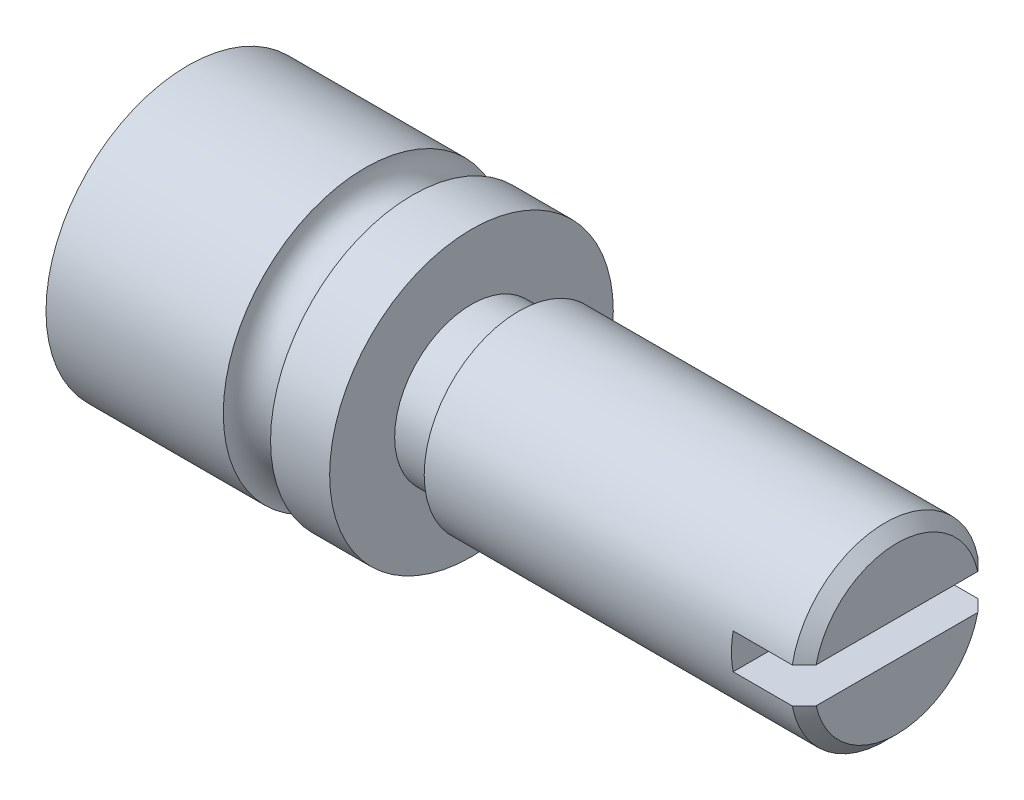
SolidWorks part; units mm, degrees
ref_plane "Face" through (0, 0, 0) normal (0, 0, 1) x (1, 0, 0)
ref_plane "Dessus" through (0, 0, 0) normal (0, 1, 0) x (1, 0, 0)
ref_plane "Droite" through (0, 0, 0) normal (1, 0, 0) x (0, 0, -1)
sketch "Esquisse1" plane through (0, 0, 0) normal (0, 0, 1) x (1, 0, 0)
  line L0 (-90.6825, 0) -> (92.9448, 0) construction
  line L1 (0, 59.1981) -> (0, -38.4599) construction
  line L2 (0, 6) -> (0, 3.25)
  line L3 (0, 3.25) -> (2, 3.25)
  line L4 (2, 3.25) -> (2, 4)
  line L5 (2, 4) -> (18, 4)
  line L6 (18, 4) -> (18, 0)
  line L7 (0, 6) -> (-2.5, 6)
  line L8 (-3.5, 13.1466) -> (-3.5, -8.9366) construction
  line L9 (4.6048, 6) -> (-13.4717, 6) construction
  line L10 (-4.5, 6) -> (-12, 6)
  line L11 (-13.0278, 0) -> (18, 0)
  line L12 (5, -11.4524) -> (5, -11.6388) construction
  line L13 (5, -11.4524) -> (5, 9.6058) construction
  arc A0 (-4.5, 6) -> (-2.5, 6) centre (-3.5, 6) ccw
  arc A1 (-12, 6) -> (-13.0278, 0) centre (5, 0) ccw
  dimension "D5" = 2
  dimension "D1" = 6.5
  dimension "D2" = 8
  dimension "D3" = 2
  dimension "D4" = 18
  dimension "D6" = 3.5
  dimension "D7" = 7.5
  dimension "D8" = 5
  dimension "D9" = 6
revolve "Base-Révolution" add sketch "Esquisse1" angle 360 about L0
chamfer "Chanfrein1" distance 0.5 angle 45
sketch "Esquisse2" plane through (0, 0, 0) normal (0, 0, 1) x (1, 0, 0)
  line L0 (0, 0) -> (19.0259, 0) construction
  line L1 (-90.6825, 0) -> (92.9448, 0) construction
  line L2 (18, -3.5) -> (18, 3.5) construction
  line L3 (15, 0.75) -> (19.0259, 0.75)
  line L4 (15, 0.75) -> (15, -0.75)
  line L5 (15, -0.75) -> (19.0259, -0.75)
  line L6 (19.0259, 0.75) -> (19.0259, -0.75)
  dimension "D1" = 0.75
  dimension "D2" = 1.5
  dimension "D3" = 3
extrude "Enlèv. mat.-Extru.1" cut sketch "Esquisse2" against normal mid plane 10
sketch "Esquisse3" plane through (0, 0, 0) normal (0, 0, 1) x (1, 0, 0)
  line L0 (0, 0) -> (-23.7691, 0) construction
  line L1 (-90.6825, 0) -> (92.9448, 0) construction
  point P5 (-13.0353, 0)
ref_plane "Plan1" through (15.7038, 0, 0) normal (1, 0, 0) x (0, 0, -1)
sketch "Esquisse4" plane through (15.7038, 0, 0) normal (1, 0, 0) x (0, 0, -1)
  line L0 (0, 0) -> (0, 20.744)
  line L1 (0, 0) -> (12.9997, 0)
  point P0 (0, 0)
